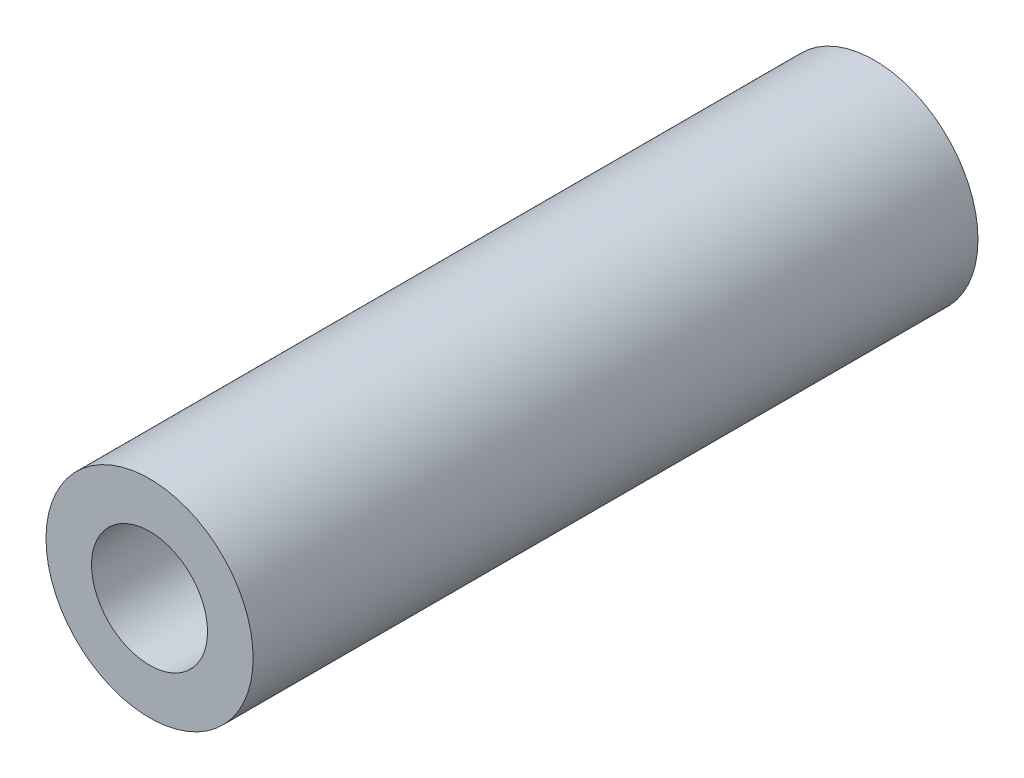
SolidWorks part; units mm, degrees
ref_plane "Front Plane" through (0, 0, 0) normal (0, 0, 1) x (1, 0, 0)
ref_plane "Top Plane" through (0, 0, 0) normal (0, 1, 0) x (1, 0, 0)
ref_plane "Right Plane" through (0, 0, 0) normal (1, 0, 0) x (0, 0, -1)
sketch "Sketch1" plane through (0, 0, 0) normal (0, 0, 1) x (1, 0, 0)
  circle A0 centre (0, 0) radius 3.175
  circle A1 centre (0, 0) radius 1.778
  dimension "OD" = 6.35
  dimension "ID" = 3.556
extrude "Extrude1" add sketch "Sketch1" along normal mid plane 22.225
sketch "Sketch2" plane through (0, 0, 0) normal (1, 0, 0) x (0, 0, -1)
  line L0 (-11.1125, -1.778) -> (11.1125, -1.778) construction
  line L3 (11.1125, 1.778) -> (-11.1125, 1.778) construction
  line L5 (-11.1125, -1.778) -> (11.1125, -1.778)
  line L6 (11.1125, 1.778) -> (-11.1125, 1.778)
sketch "Sketch4" plane through (0, 0, 11.1125) normal (0, 0, 1) x (1, 0, 0)
  line L0 (0, 0) -> (-1.2572, 1.2572)
  line L1 (0, -2.1828) -> (0, 2.1828) construction
  circle A0 centre (0, 0) radius 1.778 construction
  dimension "D1" = 45
